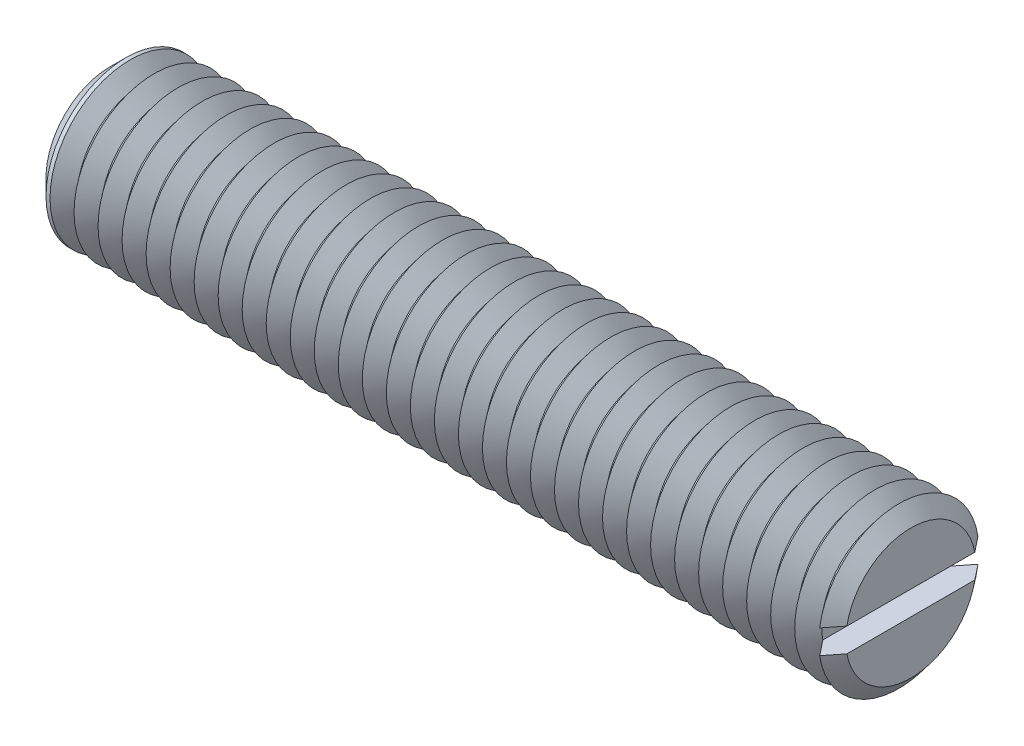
SolidWorks part; units mm, degrees
ref_plane "Front Plane" through (0, 0, 0) normal (0, 0, 1) x (1, 0, 0)
ref_plane "Top Plane" through (0, 0, 0) normal (0, 1, 0) x (1, 0, 0)
ref_plane "Right Plane" through (0, 0, 0) normal (1, 0, 0) x (0, 0, -1)
sketch "Sketch1" plane through (0, 0, 0) normal (1, 0, 0) x (0, 0, -1)
  circle A0 centre (0, 0) radius 5
  dimension "D1" = 10
extrude "Extrude1" add sketch "Sketch1" along normal mid plane 50
sketch "Sketch2" plane through (0, 0, 0) normal (0, 0, 1) x (1, 0, 0)
  line L0 (25, 0.75) -> (23.5, 0.75)
  line L1 (25, -5) -> (25, 5) construction
  line L2 (23.5, 0.75) -> (23.5, -0.75)
  line L3 (0, 0) -> (50000, 0) construction
  line L4 (25, -0.75) -> (23.5, -0.75)
  line L5 (25, -0.75) -> (25, 0.75)
  point P9 (23.5, 0)
  dimension "D1" = 1.5
extrude "Extrude2" cut sketch "Sketch2" against normal mid plane 15
chamfer "Chamfer1" distance 1 angle 45 1 edges at (-25, 0, -5)
sketch "Sketch3" plane through (0, 0, 0) normal (0, 0, 1) x (1, 0, 0)
  line L0 (0, 0) -> (30.9602, 0) construction
  line L1 (24.25, -5) -> (25.75, -5)
  line L2 (-24, -5) -> (25, -5) construction
  line L3 (25.75, -5) -> (25, -4.0633)
  line L4 (25, -5) -> (25, -0.75) construction
  line L5 (25, -4.0633) -> (24.25, -5)
  dimension "D1" = 1.5
  dimension "D2" = 1.2
revolve "Cut-Revolve1" cut sketch "Sketch3" angle 360 about L0
pattern_linear "LPattern1" count 33 spacing 1.5 along (-1, 0, 0) of "Cut-Revolve1"
equation "\"D2@Sketch3\" = \"D1@Sketch3\"*0.8"
